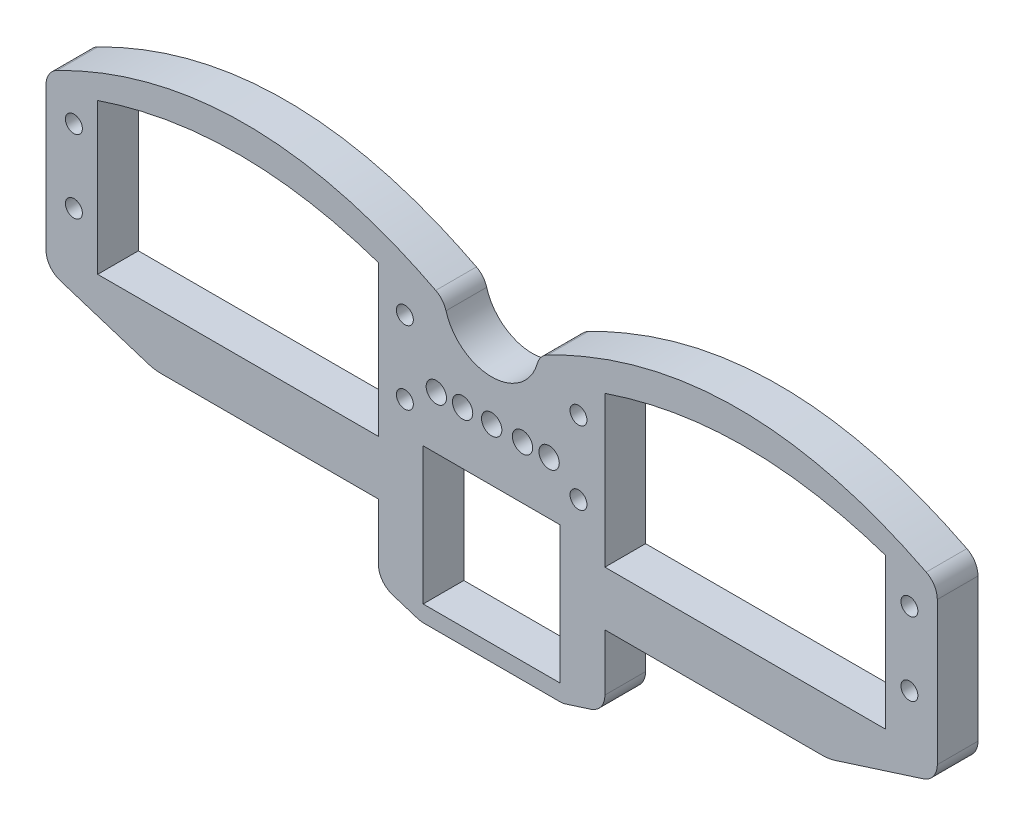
SolidWorks part; units mm, degrees
ref_plane "Front Plane" through (0, 0, 0) normal (0, 0, 1) x (1, 0, 0)
ref_plane "Top Plane" through (0, 0, 0) normal (0, 1, 0) x (1, 0, 0)
ref_plane "Right Plane" through (0, 0, 0) normal (1, 0, 0) x (0, 0, -1)
sketch "Sketch1" plane through (0, 0, 0) normal (0, 0, 1) x (1, 0, 0)
  line L0 (-235.3422, 2.6986) -> (-227.3422, 2.6986) construction
  line L1 (-227.3422, 2.6986) -> (-227.3422, 10.6986) construction
  line L2 (-293.0542, 31.0787) -> (-293.0542, 12.7986)
  line L3 (-210.6453, -5.6336) -> (-210.6453, 2.6986)
  line L4 (-217.2422, -7.4014) -> (-237.4422, -7.4014)
  line L5 (-217.2422, -7.4014) -> (-217.2422, 12.7986)
  line L6 (-217.2422, 12.7986) -> (-237.4422, 12.7986)
  line L7 (-227.3422, 33.6454) -> (-227.3422, 26.7857) construction
  line L8 (-237.4422, -7.4014) -> (-237.4422, 12.7986)
  line L9 (-217.2422, -7.4014) -> (-237.4422, 12.7986) construction
  line L10 (-217.2422, 12.7986) -> (-237.4422, -7.4014) construction
  line L11 (-293.0542, 12.7986) -> (-293.0542, 9.991)
  line L12 (-237.3756, -9.8014) -> (-217.3087, -9.8014)
  line L13 (-290.9653, 7.1327) -> (-277.9444, 2.982)
  line L15 (-285.4327, 32.8954) -> (-285.4327, 10.6986)
  line L16 (-285.4327, 10.6986) -> (-244.0391, 10.6986)
  line L17 (-244.0391, 10.6986) -> (-244.0391, 32.8954)
  line L20 (-163.719, 7.1327) -> (-176.74, 2.982)
  line L23 (-210.6453, 10.6986) -> (-210.6453, 32.8954)
  line L24 (-169.2516, 10.6986) -> (-210.6453, 10.6986)
  line L25 (-169.2516, 32.8954) -> (-169.2516, 10.6986)
  line L27 (-161.6301, 12.7986) -> (-161.6301, 9.991)
  line L28 (-161.6301, 31.0787) -> (-161.6301, 12.7986)
  line L29 (-210.6453, 2.6986) -> (-178.5622, 2.6986)
  line L30 (-212.7341, -8.4919) -> (-216.3976, -9.6597)
  line L31 (-244.0391, 2.6986) -> (-276.1221, 2.6986)
  line L32 (-244.0391, -5.6336) -> (-244.0391, 2.6986)
  line L33 (-241.9502, -8.4919) -> (-238.2867, -9.6597)
  line L34 (-244.0391, -7.826) -> (-237.8422, -9.8014)
  circle A0 centre (-288.9422, 28.1654) radius 1.25
  circle A1 centre (-288.9422, 17.3754) radius 1.25
  circle A2 centre (-240.1422, 28.1654) radius 1.25
  circle A3 centre (-240.1422, 17.3754) radius 1.25
  circle A4 centre (-214.5422, 28.1654) radius 1.25
  circle A5 centre (-214.5422, 17.3754) radius 1.25
  circle A6 centre (-165.7422, 28.1654) radius 1.25
  circle A7 centre (-165.7422, 17.3754) radius 1.25
  arc A8 (-234.0736, 31.7252) -> (-220.6107, 31.7252) centre (-227.3422, 33.6454) ccw
  arc A9 (-238.2867, -9.6597) -> (-237.3756, -9.8014) centre (-237.3756, -6.8014) ccw
  arc A10 (-217.3087, -9.8014) -> (-216.3976, -9.6597) centre (-217.3087, -6.8014) ccw
  arc A11 (-210.6453, -5.6336) -> (-212.7341, -8.4919) centre (-213.6453, -5.6336) cw
  arc A12 (-241.9502, -8.4919) -> (-244.0391, -5.6336) centre (-241.0391, -5.6336) cw
  arc A13 (-163.719, 7.1327) -> (-161.6301, 9.991) centre (-164.6301, 9.991) ccw
  arc A14 (-290.9653, 7.1327) -> (-293.0542, 9.991) centre (-290.0542, 9.991) cw
  arc A15 (-234.0736, 31.7252) -> (-235.5883, 33.571) centre (-236.9585, 30.9022) ccw
  arc A16 (-220.6107, 31.7252) -> (-219.096, 33.571) centre (-217.7258, 30.9022) cw
  arc A17 (-161.6301, 31.0787) -> (-163.2721, 33.7537) centre (-164.6301, 31.0787) ccw
  arc A18 (-293.0542, 31.0787) -> (-291.4122, 33.7537) centre (-290.0542, 31.0787) cw
  arc A19 (-176.74, 2.982) -> (-178.5622, 2.6986) centre (-178.5622, 8.6986) cw
  arc A20 (-276.1221, 2.6986) -> (-277.9444, 2.982) centre (-276.1221, 8.6986) cw
  spline S0 degree 3 poles (-291.4122, 33.7537) (-282.2335, 38.4132) (-263.6109, 43.1627) (-245.0178, 38.4122) (-235.5883, 33.571) knots 0.02797 0.02797 0.02797 0.02797 0.497008 0.978121 0.978121 0.978121 0.978121
  spline S1 degree 2 poles (-210.6453, 32.8954) (-189.9981, 39.9474) (-169.2516, 32.8954) knots 0 0 0 1 1 1
  spline S2 degree 3 poles (-163.2721, 33.7537) (-172.4508, 38.4132) (-191.0734, 43.1627) (-209.6665, 38.4122) (-219.096, 33.571) knots 0.02797 0.02797 0.02797 0.02797 0.497008 0.978121 0.978121 0.978121 0.978121
  spline S3 degree 2 poles (-244.0391, 32.8954) (-264.6862, 39.9474) (-285.4327, 32.8954) knots 0 0 0 1 1 1
  point P40 (-227.3422, -9.8014)
  point P59 (-216.8422, -9.8014)
  point P62 (-210.6453, -7.826)
  point P68 (-161.6301, 7.7986)
  point P71 (-293.0542, 7.7986)
  point P80 (-177.6291, 2.6986)
  point P85 (-277.0553, 2.6986)
  dimension "D1" = 3
  dimension "D2" = 3
  dimension "D3" = 3
  dimension "D4" = 6
extrude "Boss-Extrude1" add sketch "Sketch1" along normal blind 6 contours A17 S2 A16 A8 A15 S0 A18 L2 L11 A14 L13 A20 L31 L32 A12 L33 A9 L12 A10 L30 A11 L3 L29 A19 L20 A13 L27 L28 S3 L17 L16 L15 L23 S1 L25 L24 A7 A6 A5 A4 A3 A2
sketch "Sketch2" plane through (0, 0, 6) normal (0, 0, 1) x (1, 0, 0)
  circle A0 centre (-227.3422, 20.6078) radius 1.5
  circle A1 centre (-235.5027, 20.6078) radius 1.5
  circle A2 centre (-218.8713, 20.6078) radius 1.5
extrude "Cut-Extrude1" cut sketch "Sketch2" against normal blind 6
sketch "Sketch3" plane through (0, 0, 6) normal (0, 0, 1) x (1, 0, 0)
  circle A0 centre (-231.6276, 20.6078) radius 1.5
  circle A1 centre (-222.7904, 20.6078) radius 1.5
extrude "Cut-Extrude2" cut sketch "Sketch3" against normal blind 15
